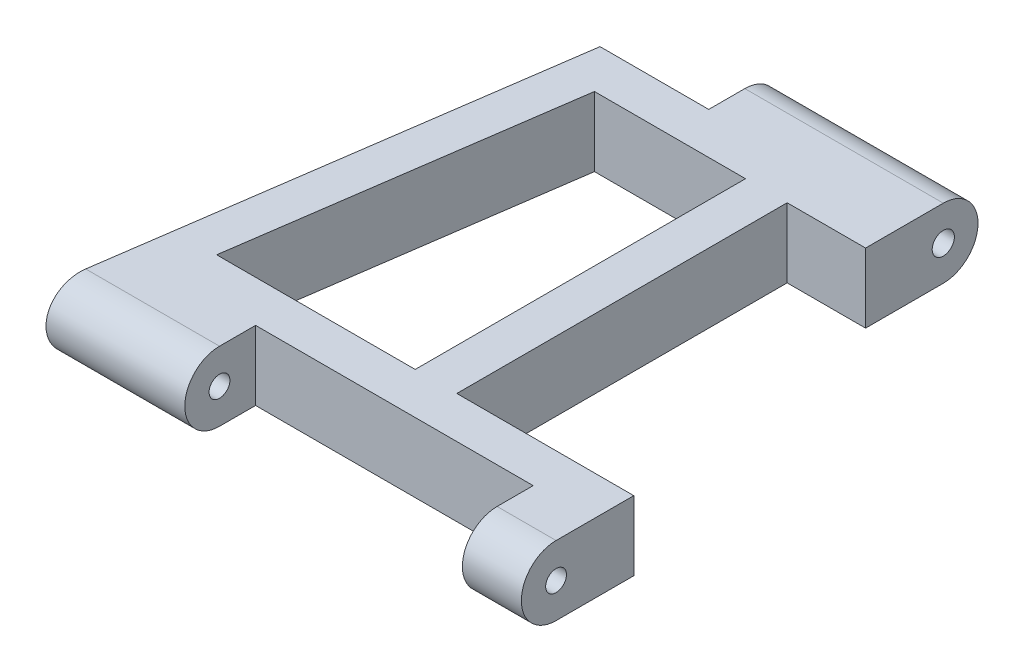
SolidWorks part; units mm, degrees
ref_plane "Спереди" through (0, 0, 0) normal (0, 0, 1) x (1, 0, 0)
ref_plane "Сверху" through (0, 0, 0) normal (0, 1, 0) x (1, 0, 0)
ref_plane "Справа" through (0, 0, 0) normal (1, 0, 0) x (0, 0, -1)
sketch "Эскиз1" plane through (0, 0, 0) normal (0, 1, 0) x (1, 0, 0)
  line L0 (-129.5038, 96.1191) -> (-71.0375, 96.1191)
  line L1 (-128.0375, 106.3191) -> (-71.0375, 106.3191)
  line L2 (-128.0375, 106.3191) -> (-128.0375, 26.3191)
  line L3 (-128.0375, 26.3191) -> (-71.0375, 26.3191)
  line L4 (-71.0375, 106.3191) -> (-71.0375, 26.3191)
  line L5 (-113.8375, 106.3191) -> (-85.2375, 106.3191)
  line L6 (-113.8375, 106.3191) -> (-113.8375, 96.1191)
  line L7 (-113.8375, 96.1191) -> (-85.2375, 96.1191)
  line L8 (-85.2375, 106.3191) -> (-85.2375, 96.1191)
  line L9 (-99.5375, 114.6654) -> (-99.5375, 17.4292) construction
  line L10 (-139.5375, 26.3191) -> (-59.5375, 26.3191)
  line L11 (-128.0375, 106.3191) -> (-139.5375, 26.3191)
  line L12 (-119.5375, 36.5191) -> (-119.5375, 26.3191)
  line L13 (-99.5375, 47.3774) -> (-99.5375, 23.4299)
  line L14 (-119.5375, 36.5191) -> (-79.5375, 36.5191)
  line L15 (-59.5375, 42.5191) -> (-139.5375, 42.5191)
  line L16 (-102.5375, 96.1191) -> (-102.5375, 42.5191)
  line L17 (-130.3663, 90.1191) -> (-71.0375, 90.1191)
  line L18 (-121.9771, 106.3105) -> (-133.4771, 26.3105)
  line L19 (-96.5375, 96.1191) -> (-96.5375, 42.5191)
  line L20 (-69.5713, 96.1191) -> (-128.0375, 96.1191)
  line L21 (-68.7088, 90.1191) -> (-128.0375, 90.1191)
  line L22 (-79.5375, 36.5191) -> (-79.5375, 26.3191)
  line L23 (-59.5375, 42.5191) -> (-59.5375, 26.3191)
  line L24 (-85.2375, 96.1191) -> (-85.2375, 90.1191)
  line L25 (-79.0375, 90.1191) -> (-79.0375, 42.5191)
  point P14 (-99.5375, 26.3191)
  point P15 (-99.5375, 26.3191)
  point P41 (-99.5375, 36.5191)
  point P42 (-99.5375, 42.5191)
  dimension "D2" = 80
  dimension "D3" = 10.2
  dimension "D4" = 28.6
  dimension "D5" = 14.2
  dimension "D6" = 14.2
  dimension "D7" = 28.5
  dimension "D8" = 8
  dimension "D10" = 20
  dimension "D11" = 20
  dimension "D12" = 10.2
  dimension "D13" = 3
  dimension "D14" = 6
  dimension "D15" = 6
  dimension "D16" = 6
extrude "Бобышка-Вытянуть1" add sketch "Эскиз1" along normal blind 10 contours L9 L1 L6 L0 L7 | L5 L9 L20 L0 L8 | L24 L0 L19 L17 | L20 L9 L21 L19 | L9 L7 L16 L17 | L9 L17 L16 L15 L13 | L21 L9 L13 L15 L19 | L0 L18 L17 L16 | L18 L0 L2 L17 | L11 L17 L2 L0 | L18 L2 L17 L11 L15 | L18 L17 L2 | L15 L18 L10 L2 | L18 L15 L11 L10 | L13 L15 L2 L3 L12 L14 | L14 L22 L10 L4 L15 L13
sketch "Эскиз2" plane through (-113.8375, 0, 0) normal (-1, 0, 0) x (0, 0, 1)
  line L4 (-106.3191, 0) -> (-96.1191, 0)
  line L5 (-96.1191, 0) -> (-96.1191, 10)
  line L6 (-96.1191, 10) -> (-106.3191, 10)
  line L7 (-106.3191, 10) -> (-106.3191, 0)
  line L8 (-106.3191, 0) -> (-96.1191, 0)
  line L9 (-96.1191, 0) -> (-96.1191, 10)
  line L10 (-96.1191, 10) -> (-106.3191, 10)
  line L11 (-106.3191, 10) -> (-106.3191, 0)
  circle A0 centre (-101.3191, 5) radius 5
  circle A1 centre (-101.3191, 5) radius 1.6
  dimension "D2" = 3.2
  dimension "D1" = 0
extrude "Вырез-Вытянуть1" cut sketch "Эскиз2" against normal up to surface (28.6 mm away) contours A1 | A0 L10 M10 | A0 L11 M7
sketch "Эскиз3" plane through (-79.5375, 0, 0) normal (-1, 0, 0) x (0, 0, 1)
  line L4 (-36.5191, 0) -> (-26.3191, 0)
  line L5 (-26.3191, 0) -> (-26.3191, 10)
  line L6 (-26.3191, 10) -> (-36.5191, 10)
  line L7 (-36.5191, 10) -> (-36.5191, 0)
  line L8 (-36.5191, 0) -> (-26.3191, 0)
  line L9 (-26.3191, 0) -> (-26.3191, 10)
  line L10 (-26.3191, 10) -> (-36.5191, 10)
  line L11 (-36.5191, 10) -> (-36.5191, 0)
  circle A0 centre (-31.3191, 5) radius 5
  circle A1 centre (-31.3191, 5) radius 1.5
  dimension "D2" = 10
  dimension "D3" = 3
  dimension "D1" = 0
extrude "Вырез-Вытянуть2" cut sketch "Эскиз3" against normal through all both and the other way through all contours A1 | A0 L9 M8 | A0 L8 M7
